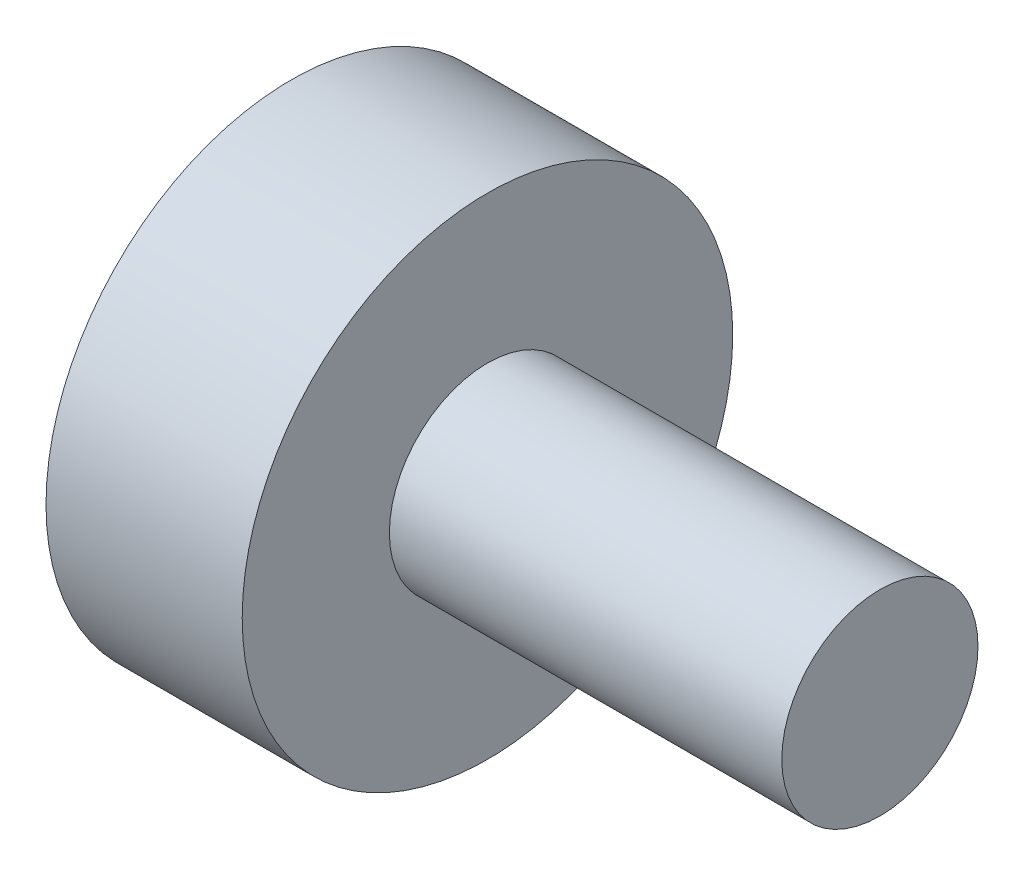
SolidWorks part; units mm, degrees
ref_plane "Plan de face" through (0, 0, 0) normal (0, 0, 1) x (1, 0, 0)
ref_plane "Plan de dessus" through (0, 0, 0) normal (0, 1, 0) x (1, 0, 0)
ref_plane "Plan de droite" through (0, 0, 0) normal (1, 0, 0) x (0, 0, -1)
sketch "Esquisse1" plane through (0, 0, 0) normal (0, 0, 1) x (1, 0, 0)
  line L0 (0, 0) -> (0, 25)
  line L1 (0, 25) -> (20, 25)
  line L2 (20, 25) -> (20, 10)
  line L3 (20, 10) -> (60, 10)
  line L4 (60, 10) -> (60, 0)
  line L5 (60, 0) -> (0, 0)
  line L6 (-9.4287, 0) -> (68.3662, 0) construction
  dimension "D1" = 10
  dimension "D2" = 25
  dimension "D3" = 20
  dimension "D4" = 60
revolve "Révolution1" add sketch "Esquisse1" angle 360 about L6
